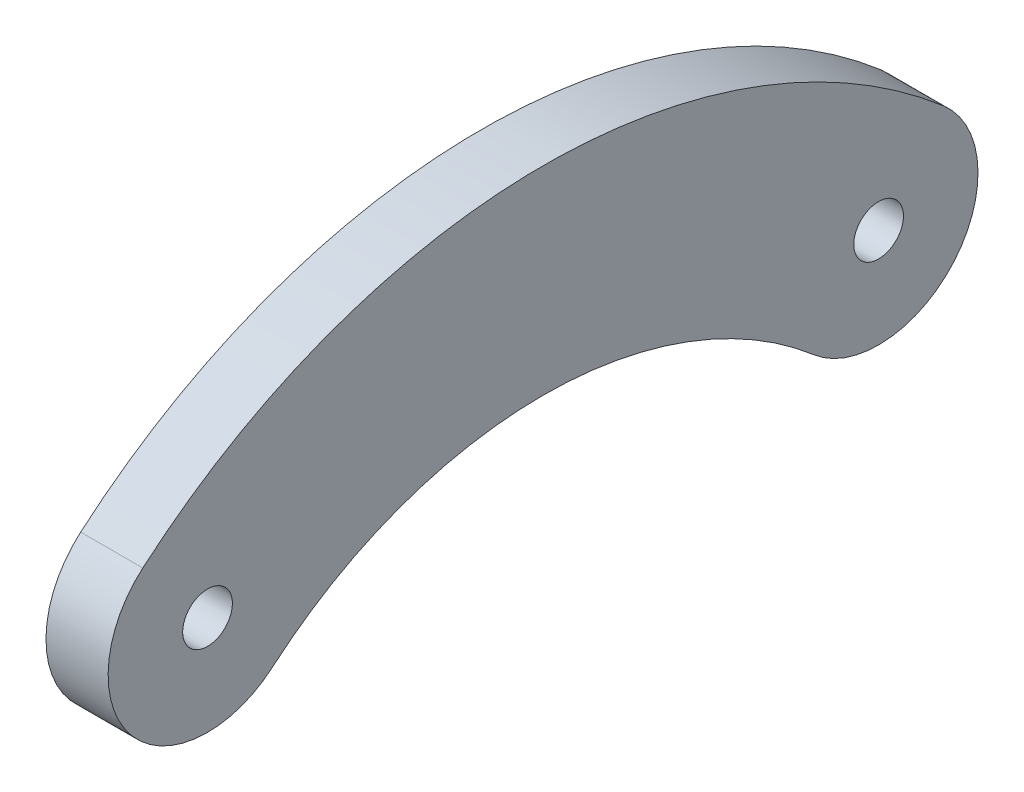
SolidWorks part; units mm, degrees
ref_plane "前视" through (0, 0, 0) normal (0, 0, 1) x (1, 0, 0)
ref_plane "上视" through (0, 0, 0) normal (0, 1, 0) x (1, 0, 0)
ref_plane "右视" through (0, 0, 0) normal (1, 0, 0) x (0, 0, -1)
sketch "草图1" plane through (0, 0, 0) normal (1, 0, 0) x (0, 0, -1)
  arc A0 (0, 0) -> (27, 0) centre (13.5, -15.725) cw construction
  arc A1 (29.6055, 3.035) -> (-2.6055, 3.035) centre (13.5, -15.725) ccw
  arc A2 (24.3945, -3.035) -> (2.6055, -3.035) centre (13.5, -15.725) ccw
  arc A3 (24.3945, -3.035) -> (29.6055, 3.035) centre (27, 0) ccw
  arc A4 (-2.6055, 3.035) -> (2.6055, -3.035) centre (0, 0) ccw
  circle A5 centre (0, 0) radius 1
  circle A6 centre (27, 0) radius 1
  point P3 (13.5, 5)
  dimension "D1" = 35
  dimension "D2" = 4
  dimension "D3" = 13
  dimension "D4" = 2
extrude "凸台-拉伸1" add sketch "草图1" along normal mid plane 2.5
